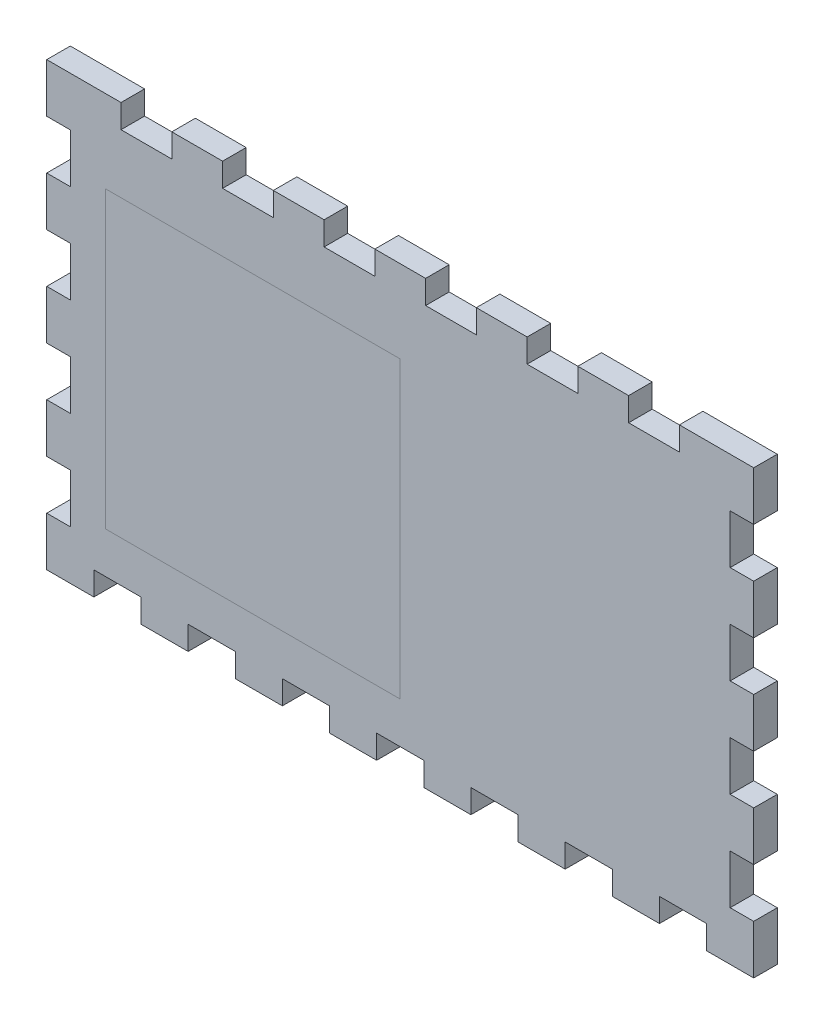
SolidWorks part; units mm, degrees
ref_plane "Front Plane" through (0, 0, 0) normal (0, 0, 1) x (1, 0, 0)
ref_plane "Top Plane" through (0, 0, 0) normal (0, 1, 0) x (1, 0, 0)
ref_plane "Right Plane" through (0, 0, 0) normal (1, 0, 0) x (0, 0, -1)
sketch "Model" plane through (0, 0, 0) normal (0, 0, 1) x (1, 0, 0)
  line L0 (83, 83) -> (87, 83)
  line L1 (87, 83) -> (87, 79)
  line L2 (87, 79) -> (95, 79)
  line L3 (95, 79) -> (95, 83)
  line L4 (95, 83) -> (103, 83)
  line L5 (103, 83) -> (103, 79)
  line L6 (103, 79) -> (111, 79)
  line L7 (111, 79) -> (111, 83)
  line L8 (111, 83) -> (119, 83)
  line L9 (119, 83) -> (119, 79)
  line L10 (119, 79) -> (127, 79)
  line L11 (127, 79) -> (127, 83)
  line L12 (127, 83) -> (135, 83)
  line L13 (135, 83) -> (135, 79)
  line L14 (135, 79) -> (143, 79)
  line L15 (143, 79) -> (143, 83)
  line L16 (143, 83) -> (151, 83)
  line L17 (151, 83) -> (151, 79)
  line L18 (151, 79) -> (159, 79)
  line L19 (159, 79) -> (159, 83)
  line L20 (159, 83) -> (167, 83)
  line L21 (167, 83) -> (167, 79)
  line L22 (167, 79) -> (175, 79)
  line L23 (175, 79) -> (175, 83)
  line L24 (175, 83) -> (183, 83)
  line L25 (183, 83) -> (183, 79)
  line L26 (183, 79) -> (191, 79)
  line L27 (191, 79) -> (191, 83)
  line L28 (191, 83) -> (195, 83)
  line L29 (195, 83) -> (195, 91.61)
  line L30 (195, 91.61) -> (199, 91.61)
  line L31 (199, 91.61) -> (199, 100.23)
  line L32 (199, 100.23) -> (195, 100.23)
  line L33 (195, 100.23) -> (195, 108.85)
  line L34 (195, 108.85) -> (199, 108.85)
  line L35 (199, 108.85) -> (199, 117.46)
  line L36 (199, 117.46) -> (195, 117.46)
  line L37 (195, 117.46) -> (195, 126.08)
  line L38 (195, 126.08) -> (199, 126.08)
  line L39 (199, 126.08) -> (199, 134.69)
  line L40 (199, 134.69) -> (195, 134.69)
  line L41 (195, 134.69) -> (195, 143.31)
  line L42 (195, 143.31) -> (199, 143.31)
  line L43 (199, 143.31) -> (199, 151.92)
  line L44 (199, 151.92) -> (195, 151.92)
  line L45 (195, 151.92) -> (195, 160.54)
  line L46 (195, 160.54) -> (199, 160.54)
  line L47 (199, 160.54) -> (199, 169.15)
  line L48 (199, 169.15) -> (195, 169.15)
  line L49 (195, 169.15) -> (195, 177.77)
  line L50 (195, 177.77) -> (199, 177.77)
  line L51 (199, 177.77) -> (199, 186.38)
  line L52 (199, 186.38) -> (195, 186.38)
  line L53 (195, 186.38) -> (195, 195)
  line L54 (195, 195) -> (191, 195)
  line L55 (191, 195) -> (191, 199)
  line L56 (191, 199) -> (183, 199)
  line L57 (183, 199) -> (183, 195)
  line L58 (183, 195) -> (175, 195)
  line L59 (175, 195) -> (175, 199)
  line L60 (175, 199) -> (167, 199)
  line L61 (167, 199) -> (167, 195)
  line L62 (167, 195) -> (159, 195)
  line L63 (159, 195) -> (159, 199)
  line L64 (159, 199) -> (151, 199)
  line L65 (151, 199) -> (151, 195)
  line L66 (151, 195) -> (143, 195)
  line L67 (143, 195) -> (143, 199)
  line L68 (143, 199) -> (135, 199)
  line L69 (135, 199) -> (135, 195)
  line L70 (135, 195) -> (127, 195)
  line L71 (127, 195) -> (127, 199)
  line L72 (127, 199) -> (119, 199)
  line L73 (119, 199) -> (119, 195)
  line L74 (119, 195) -> (111, 195)
  line L75 (111, 195) -> (111, 199)
  line L76 (111, 199) -> (103, 199)
  line L77 (103, 199) -> (103, 195)
  line L78 (103, 195) -> (95, 195)
  line L79 (95, 195) -> (95, 199)
  line L80 (95, 199) -> (87, 199)
  line L81 (87, 199) -> (87, 195)
  line L82 (87, 195) -> (83, 195)
  line L83 (83, 195) -> (83, 186.38)
  line L84 (83, 186.38) -> (79, 186.38)
  line L85 (79, 186.38) -> (79, 177.77)
  line L86 (79, 177.77) -> (83, 177.77)
  line L87 (83, 177.77) -> (83, 169.15)
  line L88 (83, 169.15) -> (79, 169.15)
  line L89 (79, 169.15) -> (79, 160.54)
  line L90 (79, 160.54) -> (83, 160.54)
  line L91 (83, 160.54) -> (83, 151.92)
  line L92 (83, 151.92) -> (79, 151.92)
  line L93 (79, 151.92) -> (79, 143.31)
  line L94 (79, 143.31) -> (83, 143.31)
  line L95 (83, 143.31) -> (83, 134.69)
  line L96 (83, 134.69) -> (79, 134.69)
  line L97 (79, 134.69) -> (79, 126.08)
  line L98 (79, 126.08) -> (83, 126.08)
  line L99 (83, 126.08) -> (83, 117.46)
  line L100 (83, 117.46) -> (79, 117.46)
  line L101 (79, 117.46) -> (79, 108.85)
  line L102 (79, 108.85) -> (83, 108.85)
  line L103 (83, 108.85) -> (83, 100.23)
  line L104 (83, 100.23) -> (79, 100.23)
  line L105 (79, 100.23) -> (79, 91.61)
  line L106 (79, 91.61) -> (83, 91.61)
  line L107 (83, 91.61) -> (83, 83)
  line L108 (83, 0) -> (91.61, 0)
  line L109 (91.61, 0) -> (91.61, 4)
  line L110 (91.61, 4) -> (100.23, 4)
  line L111 (100.23, 4) -> (100.23, 0)
  line L112 (100.23, 0) -> (108.85, 0)
  line L113 (108.85, 0) -> (108.85, 4)
  line L114 (108.85, 4) -> (117.46, 4)
  line L115 (117.46, 4) -> (117.46, 0)
  line L116 (117.46, 0) -> (126.08, 0)
  line L117 (126.08, 0) -> (126.08, 4)
  line L118 (126.08, 4) -> (134.69, 4)
  line L119 (134.69, 4) -> (134.69, 0)
  line L120 (134.69, 0) -> (143.31, 0)
  line L121 (143.31, 0) -> (143.31, 4)
  line L122 (143.31, 4) -> (151.92, 4)
  line L123 (151.92, 4) -> (151.92, 0)
  line L124 (151.92, 0) -> (160.54, 0)
  line L125 (160.54, 0) -> (160.54, 4)
  line L126 (160.54, 4) -> (169.15, 4)
  line L127 (169.15, 4) -> (169.15, 0)
  line L128 (169.15, 0) -> (177.77, 0)
  line L129 (177.77, 0) -> (177.77, 4)
  line L130 (177.77, 4) -> (186.38, 4)
  line L131 (186.38, 4) -> (186.38, 0)
  line L132 (186.38, 0) -> (195, 0)
  line L133 (195, 0) -> (199, 0)
  line L134 (199, 0) -> (199, 8.33)
  line L135 (199, 8.33) -> (195, 8.33)
  line L136 (195, 8.33) -> (195, 16.67)
  line L137 (195, 16.67) -> (199, 16.67)
  line L138 (199, 16.67) -> (199, 25)
  line L139 (199, 25) -> (195, 25)
  line L140 (195, 25) -> (195, 33.33)
  line L141 (195, 33.33) -> (199, 33.33)
  line L142 (199, 33.33) -> (199, 41.67)
  line L143 (199, 41.67) -> (195, 41.67)
  line L144 (195, 41.67) -> (195, 50)
  line L145 (195, 50) -> (199, 50)
  line L146 (199, 50) -> (199, 58.33)
  line L147 (199, 58.33) -> (195, 58.33)
  line L148 (195, 58.33) -> (195, 66.67)
  line L149 (195, 66.67) -> (199, 66.67)
  line L150 (199, 66.67) -> (199, 75)
  line L151 (199, 75) -> (191, 75)
  line L152 (191, 75) -> (191, 71)
  line L153 (191, 71) -> (183, 71)
  line L154 (183, 71) -> (183, 75)
  line L155 (183, 75) -> (175, 75)
  line L156 (175, 75) -> (175, 71)
  line L157 (175, 71) -> (167, 71)
  line L158 (167, 71) -> (167, 75)
  line L159 (167, 75) -> (159, 75)
  line L160 (159, 75) -> (159, 71)
  line L161 (159, 71) -> (151, 71)
  line L162 (151, 71) -> (151, 75)
  line L163 (151, 75) -> (143, 75)
  line L164 (143, 75) -> (143, 71)
  line L165 (143, 71) -> (135, 71)
  line L166 (135, 71) -> (135, 75)
  line L167 (135, 75) -> (127, 75)
  line L168 (127, 75) -> (127, 71)
  line L169 (127, 71) -> (119, 71)
  line L170 (119, 71) -> (119, 75)
  line L171 (119, 75) -> (111, 75)
  line L172 (111, 75) -> (111, 71)
  line L173 (111, 71) -> (103, 71)
  line L174 (103, 71) -> (103, 75)
  line L175 (103, 75) -> (95, 75)
  line L176 (95, 75) -> (95, 71)
  line L177 (95, 71) -> (87, 71)
  line L178 (87, 71) -> (87, 75)
  line L179 (87, 75) -> (79, 75)
  line L180 (79, 75) -> (79, 66.67)
  line L181 (79, 66.67) -> (83, 66.67)
  line L182 (83, 66.67) -> (83, 58.33)
  line L183 (83, 58.33) -> (79, 58.33)
  line L184 (79, 58.33) -> (79, 50)
  line L185 (79, 50) -> (83, 50)
  line L186 (83, 50) -> (83, 41.67)
  line L187 (83, 41.67) -> (79, 41.67)
  line L188 (79, 41.67) -> (79, 33.33)
  line L189 (79, 33.33) -> (83, 33.33)
  line L190 (83, 33.33) -> (83, 25)
  line L191 (83, 25) -> (79, 25)
  line L192 (79, 25) -> (79, 16.67)
  line L193 (79, 16.67) -> (83, 16.67)
  line L194 (83, 16.67) -> (83, 8.33)
  line L195 (83, 8.33) -> (79, 8.33)
  line L196 (79, 8.33) -> (79, 0)
  line L197 (79, 0) -> (83, 0)
  line L198 (83, 278) -> (91.61, 278)
  line L199 (91.61, 278) -> (91.61, 274)
  line L200 (91.61, 274) -> (100.23, 274)
  line L201 (100.23, 274) -> (100.23, 278)
  line L202 (100.23, 278) -> (108.85, 278)
  line L203 (108.85, 278) -> (108.85, 274)
  line L204 (108.85, 274) -> (117.46, 274)
  line L205 (117.46, 274) -> (117.46, 278)
  line L206 (117.46, 278) -> (126.08, 278)
  line L207 (126.08, 278) -> (126.08, 274)
  line L208 (126.08, 274) -> (134.69, 274)
  line L209 (134.69, 274) -> (134.69, 278)
  line L210 (134.69, 278) -> (143.31, 278)
  line L211 (143.31, 278) -> (143.31, 274)
  line L212 (143.31, 274) -> (151.92, 274)
  line L213 (151.92, 274) -> (151.92, 278)
  line L214 (151.92, 278) -> (160.54, 278)
  line L215 (160.54, 278) -> (160.54, 274)
  line L216 (160.54, 274) -> (169.15, 274)
  line L217 (169.15, 274) -> (169.15, 278)
  line L218 (169.15, 278) -> (177.77, 278)
  line L219 (177.77, 278) -> (177.77, 274)
  line L220 (177.77, 274) -> (186.38, 274)
  line L221 (186.38, 274) -> (186.38, 278)
  line L222 (186.38, 278) -> (195, 278)
  line L223 (195, 278) -> (199, 278)
  line L224 (199, 278) -> (199, 269.67)
  line L225 (199, 269.67) -> (195, 269.67)
  line L226 (195, 269.67) -> (195, 261.33)
  line L227 (195, 261.33) -> (199, 261.33)
  line L228 (199, 261.33) -> (199, 253)
  line L229 (199, 253) -> (195, 253)
  line L230 (195, 253) -> (195, 244.67)
  line L231 (195, 244.67) -> (199, 244.67)
  line L232 (199, 244.67) -> (199, 236.33)
  line L233 (199, 236.33) -> (195, 236.33)
  line L234 (195, 236.33) -> (195, 228)
  line L235 (195, 228) -> (199, 228)
  line L236 (199, 228) -> (199, 219.67)
  line L237 (199, 219.67) -> (195, 219.67)
  line L238 (195, 219.67) -> (195, 211.33)
  line L239 (195, 211.33) -> (199, 211.33)
  line L240 (199, 211.33) -> (199, 203)
  line L241 (199, 203) -> (191, 203)
  line L242 (191, 203) -> (191, 207)
  line L243 (191, 207) -> (183, 207)
  line L244 (183, 207) -> (183, 203)
  line L245 (183, 203) -> (175, 203)
  line L246 (175, 203) -> (175, 207)
  line L247 (175, 207) -> (167, 207)
  line L248 (167, 207) -> (167, 203)
  line L249 (167, 203) -> (159, 203)
  line L250 (159, 203) -> (159, 207)
  line L251 (159, 207) -> (151, 207)
  line L252 (151, 207) -> (151, 203)
  line L253 (151, 203) -> (143, 203)
  line L254 (143, 203) -> (143, 207)
  line L255 (143, 207) -> (135, 207)
  line L256 (135, 207) -> (135, 203)
  line L257 (135, 203) -> (127, 203)
  line L258 (127, 203) -> (127, 207)
  line L259 (127, 207) -> (119, 207)
  line L260 (119, 207) -> (119, 203)
  line L261 (119, 203) -> (111, 203)
  line L262 (111, 203) -> (111, 207)
  line L263 (111, 207) -> (103, 207)
  line L264 (103, 207) -> (103, 203)
  line L265 (103, 203) -> (95, 203)
  line L266 (95, 203) -> (95, 207)
  line L267 (95, 207) -> (87, 207)
  line L268 (87, 207) -> (87, 203)
  line L269 (87, 203) -> (79, 203)
  line L270 (79, 203) -> (79, 211.33)
  line L271 (79, 211.33) -> (83, 211.33)
  line L272 (83, 211.33) -> (83, 219.67)
  line L273 (83, 219.67) -> (79, 219.67)
  line L274 (79, 219.67) -> (79, 228)
  line L275 (79, 228) -> (83, 228)
  line L276 (83, 228) -> (83, 236.33)
  line L277 (83, 236.33) -> (79, 236.33)
  line L278 (79, 236.33) -> (79, 244.67)
  line L279 (79, 244.67) -> (83, 244.67)
  line L280 (83, 244.67) -> (83, 253)
  line L281 (83, 253) -> (79, 253)
  line L282 (79, 253) -> (79, 261.33)
  line L283 (79, 261.33) -> (83, 261.33)
  line L284 (83, 261.33) -> (83, 269.67)
  line L285 (83, 269.67) -> (79, 269.67)
  line L286 (79, 269.67) -> (79, 278)
  line L287 (79, 278) -> (83, 278)
  line L288 (0, 83) -> (0, 91.61)
  line L289 (0, 91.61) -> (4, 91.61)
  line L290 (4, 91.61) -> (4, 100.23)
  line L291 (4, 100.23) -> (0, 100.23)
  line L292 (0, 100.23) -> (0, 108.85)
  line L293 (0, 108.85) -> (4, 108.85)
  line L294 (4, 108.85) -> (4, 117.46)
  line L295 (4, 117.46) -> (0, 117.46)
  line L296 (0, 117.46) -> (0, 126.08)
  line L297 (0, 126.08) -> (4, 126.08)
  line L298 (4, 126.08) -> (4, 134.69)
  line L299 (4, 134.69) -> (0, 134.69)
  line L300 (0, 134.69) -> (0, 143.31)
  line L301 (0, 143.31) -> (4, 143.31)
  line L302 (4, 143.31) -> (4, 151.92)
  line L303 (4, 151.92) -> (0, 151.92)
  line L304 (0, 151.92) -> (0, 160.54)
  line L305 (0, 160.54) -> (4, 160.54)
  line L306 (4, 160.54) -> (4, 169.15)
  line L307 (4, 169.15) -> (0, 169.15)
  line L308 (0, 169.15) -> (0, 177.77)
  line L309 (0, 177.77) -> (4, 177.77)
  line L310 (4, 177.77) -> (4, 186.38)
  line L311 (4, 186.38) -> (0, 186.38)
  line L312 (0, 186.38) -> (0, 195)
  line L313 (0, 195) -> (8.33, 195)
  line L314 (8.33, 195) -> (8.33, 199)
  line L315 (8.33, 199) -> (16.67, 199)
  line L316 (16.67, 199) -> (16.67, 195)
  line L317 (16.67, 195) -> (25, 195)
  line L318 (25, 195) -> (25, 199)
  line L319 (25, 199) -> (33.33, 199)
  line L320 (33.33, 199) -> (33.33, 195)
  line L321 (33.33, 195) -> (41.67, 195)
  line L322 (41.67, 195) -> (41.67, 199)
  line L323 (41.67, 199) -> (50, 199)
  line L324 (50, 199) -> (50, 195)
  line L325 (50, 195) -> (58.33, 195)
  line L326 (58.33, 195) -> (58.33, 199)
  line L327 (58.33, 199) -> (66.67, 199)
  line L328 (66.67, 199) -> (66.67, 195)
  line L329 (66.67, 195) -> (75, 195)
  line L330 (75, 195) -> (75, 186.38)
  line L331 (75, 186.38) -> (71, 186.38)
  line L332 (71, 186.38) -> (71, 177.77)
  line L333 (71, 177.77) -> (75, 177.77)
  line L334 (75, 177.77) -> (75, 169.15)
  line L335 (75, 169.15) -> (71, 169.15)
  line L336 (71, 169.15) -> (71, 160.54)
  line L337 (71, 160.54) -> (75, 160.54)
  line L338 (75, 160.54) -> (75, 151.92)
  line L339 (75, 151.92) -> (71, 151.92)
  line L340 (71, 151.92) -> (71, 143.31)
  line L341 (71, 143.31) -> (75, 143.31)
  line L342 (75, 143.31) -> (75, 134.69)
  line L343 (75, 134.69) -> (71, 134.69)
  line L344 (71, 134.69) -> (71, 126.08)
  line L345 (71, 126.08) -> (75, 126.08)
  line L346 (75, 126.08) -> (75, 117.46)
  line L347 (75, 117.46) -> (71, 117.46)
  line L348 (71, 117.46) -> (71, 108.85)
  line L349 (71, 108.85) -> (75, 108.85)
  line L350 (75, 108.85) -> (75, 100.23)
  line L351 (75, 100.23) -> (71, 100.23)
  line L352 (71, 100.23) -> (71, 91.61)
  line L353 (71, 91.61) -> (75, 91.61)
  line L354 (75, 91.61) -> (75, 83)
  line L355 (75, 83) -> (66.67, 83)
  line L356 (66.67, 83) -> (66.67, 79)
  line L357 (66.67, 79) -> (58.33, 79)
  line L358 (58.33, 79) -> (58.33, 83)
  line L359 (58.33, 83) -> (50, 83)
  line L360 (50, 83) -> (50, 79)
  line L361 (50, 79) -> (41.67, 79)
  line L362 (41.67, 79) -> (41.67, 83)
  line L363 (41.67, 83) -> (33.33, 83)
  line L364 (33.33, 83) -> (33.33, 79)
  line L365 (33.33, 79) -> (25, 79)
  line L366 (25, 79) -> (25, 83)
  line L367 (25, 83) -> (16.67, 83)
  line L368 (16.67, 83) -> (16.67, 79)
  line L369 (16.67, 79) -> (8.33, 79)
  line L370 (8.33, 79) -> (8.33, 83)
  line L371 (8.33, 83) -> (0, 83)
  line L372 (278, 83) -> (278, 91.61)
  line L373 (278, 91.61) -> (274, 91.61)
  line L374 (274, 91.61) -> (274, 100.23)
  line L375 (274, 100.23) -> (278, 100.23)
  line L376 (278, 100.23) -> (278, 108.85)
  line L377 (278, 108.85) -> (274, 108.85)
  line L378 (274, 108.85) -> (274, 117.46)
  line L379 (274, 117.46) -> (278, 117.46)
  line L380 (278, 117.46) -> (278, 126.08)
  line L381 (278, 126.08) -> (274, 126.08)
  line L382 (274, 126.08) -> (274, 134.69)
  line L383 (274, 134.69) -> (278, 134.69)
  line L384 (278, 134.69) -> (278, 143.31)
  line L385 (278, 143.31) -> (274, 143.31)
  line L386 (274, 143.31) -> (274, 151.92)
  line L387 (274, 151.92) -> (278, 151.92)
  line L388 (278, 151.92) -> (278, 160.54)
  line L389 (278, 160.54) -> (274, 160.54)
  line L390 (274, 160.54) -> (274, 169.15)
  line L391 (274, 169.15) -> (278, 169.15)
  line L392 (278, 169.15) -> (278, 177.77)
  line L393 (278, 177.77) -> (274, 177.77)
  line L394 (274, 177.77) -> (274, 186.38)
  line L395 (274, 186.38) -> (278, 186.38)
  line L396 (278, 186.38) -> (278, 195)
  line L397 (278, 195) -> (269.67, 195)
  line L398 (269.67, 195) -> (269.67, 199)
  line L399 (269.67, 199) -> (261.33, 199)
  line L400 (261.33, 199) -> (261.33, 195)
  line L401 (261.33, 195) -> (253, 195)
  line L402 (253, 195) -> (253, 199)
  line L403 (253, 199) -> (244.67, 199)
  line L404 (244.67, 199) -> (244.67, 195)
  line L405 (244.67, 195) -> (236.33, 195)
  line L406 (236.33, 195) -> (236.33, 199)
  line L407 (236.33, 199) -> (228, 199)
  line L408 (228, 199) -> (228, 195)
  line L409 (228, 195) -> (219.67, 195)
  line L410 (219.67, 195) -> (219.67, 199)
  line L411 (219.67, 199) -> (211.33, 199)
  line L412 (211.33, 199) -> (211.33, 195)
  line L413 (211.33, 195) -> (203, 195)
  line L414 (203, 195) -> (203, 186.38)
  line L415 (203, 186.38) -> (207, 186.38)
  line L416 (207, 186.38) -> (207, 177.77)
  line L417 (207, 177.77) -> (203, 177.77)
  line L418 (203, 177.77) -> (203, 169.15)
  line L419 (203, 169.15) -> (207, 169.15)
  line L420 (207, 169.15) -> (207, 160.54)
  line L421 (207, 160.54) -> (203, 160.54)
  line L422 (203, 160.54) -> (203, 151.92)
  line L423 (203, 151.92) -> (207, 151.92)
  line L424 (207, 151.92) -> (207, 143.31)
  line L425 (207, 143.31) -> (203, 143.31)
  line L426 (203, 143.31) -> (203, 134.69)
  line L427 (203, 134.69) -> (207, 134.69)
  line L428 (207, 134.69) -> (207, 126.08)
  line L429 (207, 126.08) -> (203, 126.08)
  line L430 (203, 126.08) -> (203, 117.46)
  line L431 (203, 117.46) -> (207, 117.46)
  line L432 (207, 117.46) -> (207, 108.85)
  line L433 (207, 108.85) -> (203, 108.85)
  line L434 (203, 108.85) -> (203, 100.23)
  line L435 (203, 100.23) -> (207, 100.23)
  line L436 (207, 100.23) -> (207, 91.61)
  line L437 (207, 91.61) -> (203, 91.61)
  line L438 (203, 91.61) -> (203, 83)
  line L439 (203, 83) -> (211.33, 83)
  line L440 (211.33, 83) -> (211.33, 79)
  line L441 (211.33, 79) -> (219.67, 79)
  line L442 (219.67, 79) -> (219.67, 83)
  line L443 (219.67, 83) -> (228, 83)
  line L444 (228, 83) -> (228, 79)
  line L445 (228, 79) -> (236.33, 79)
  line L446 (236.33, 79) -> (236.33, 83)
  line L447 (236.33, 83) -> (244.67, 83)
  line L448 (244.67, 83) -> (244.67, 79)
  line L449 (244.67, 79) -> (253, 79)
  line L450 (253, 79) -> (253, 83)
  line L451 (253, 83) -> (261.33, 83)
  line L452 (261.33, 83) -> (261.33, 79)
  line L453 (261.33, 79) -> (269.67, 79)
  line L454 (269.67, 79) -> (269.67, 83)
  line L455 (269.67, 83) -> (278, 83)
  line L456 (83, 286) -> (91.61, 286)
  line L457 (91.61, 286) -> (91.61, 282)
  line L458 (91.61, 282) -> (100.23, 282)
  line L459 (100.23, 282) -> (100.23, 286)
  line L460 (100.23, 286) -> (108.85, 286)
  line L461 (108.85, 286) -> (108.85, 282)
  line L462 (108.85, 282) -> (117.46, 282)
  line L463 (117.46, 282) -> (117.46, 286)
  line L464 (117.46, 286) -> (126.08, 286)
  line L465 (126.08, 286) -> (126.08, 282)
  line L466 (126.08, 282) -> (134.69, 282)
  line L467 (134.69, 282) -> (134.69, 286)
  line L468 (134.69, 286) -> (143.31, 286)
  line L469 (143.31, 286) -> (143.31, 282)
  line L470 (143.31, 282) -> (151.92, 282)
  line L471 (151.92, 282) -> (151.92, 286)
  line L472 (151.92, 286) -> (160.54, 286)
  line L473 (160.54, 286) -> (160.54, 282)
  line L474 (160.54, 282) -> (169.15, 282)
  line L475 (169.15, 282) -> (169.15, 286)
  line L476 (169.15, 286) -> (177.77, 286)
  line L477 (177.77, 286) -> (177.77, 282)
  line L478 (177.77, 282) -> (186.38, 282)
  line L479 (186.38, 282) -> (186.38, 286)
  line L480 (186.38, 286) -> (195, 286)
  line L481 (195, 286) -> (195, 294.62)
  line L482 (195, 294.62) -> (199, 294.62)
  line L483 (199, 294.62) -> (199, 303.23)
  line L484 (199, 303.23) -> (195, 303.23)
  line L485 (195, 303.23) -> (195, 311.85)
  line L486 (195, 311.85) -> (199, 311.85)
  line L487 (199, 311.85) -> (199, 320.46)
  line L488 (199, 320.46) -> (195, 320.46)
  line L489 (195, 320.46) -> (195, 329.08)
  line L490 (195, 329.08) -> (199, 329.08)
  line L491 (199, 329.08) -> (199, 337.69)
  line L492 (199, 337.69) -> (195, 337.69)
  line L493 (195, 337.69) -> (195, 346.31)
  line L494 (195, 346.31) -> (199, 346.31)
  line L495 (199, 346.31) -> (199, 354.92)
  line L496 (199, 354.92) -> (195, 354.92)
  line L497 (195, 354.92) -> (195, 363.54)
  line L498 (195, 363.54) -> (199, 363.54)
  line L499 (199, 363.54) -> (199, 372.15)
  line L500 (199, 372.15) -> (195, 372.15)
  line L501 (195, 372.15) -> (195, 380.77)
  line L502 (195, 380.77) -> (199, 380.77)
  line L503 (199, 380.77) -> (199, 389.38)
  line L504 (199, 389.38) -> (195, 389.38)
  line L505 (195, 389.38) -> (195, 398)
  line L506 (195, 398) -> (186.38, 398)
  line L507 (186.38, 398) -> (186.38, 402)
  line L508 (186.38, 402) -> (177.77, 402)
  line L509 (177.77, 402) -> (177.77, 398)
  line L510 (177.77, 398) -> (169.15, 398)
  line L511 (169.15, 398) -> (169.15, 402)
  line L512 (169.15, 402) -> (160.54, 402)
  line L513 (160.54, 402) -> (160.54, 398)
  line L514 (160.54, 398) -> (151.92, 398)
  line L515 (151.92, 398) -> (151.92, 402)
  line L516 (151.92, 402) -> (143.31, 402)
  line L517 (143.31, 402) -> (143.31, 398)
  line L518 (143.31, 398) -> (134.69, 398)
  line L519 (134.69, 398) -> (134.69, 402)
  line L520 (134.69, 402) -> (126.08, 402)
  line L521 (126.08, 402) -> (126.08, 398)
  line L522 (126.08, 398) -> (117.46, 398)
  line L523 (117.46, 398) -> (117.46, 402)
  line L524 (117.46, 402) -> (108.85, 402)
  line L525 (108.85, 402) -> (108.85, 398)
  line L526 (108.85, 398) -> (100.23, 398)
  line L527 (100.23, 398) -> (100.23, 402)
  line L528 (100.23, 402) -> (91.61, 402)
  line L529 (91.61, 402) -> (91.61, 398)
  line L530 (91.61, 398) -> (83, 398)
  line L531 (83, 398) -> (83, 389.38)
  line L532 (83, 389.38) -> (79, 389.38)
  line L533 (79, 389.38) -> (79, 380.77)
  line L534 (79, 380.77) -> (83, 380.77)
  line L535 (83, 380.77) -> (83, 372.15)
  line L536 (83, 372.15) -> (79, 372.15)
  line L537 (79, 372.15) -> (79, 363.54)
  line L538 (79, 363.54) -> (83, 363.54)
  line L539 (83, 363.54) -> (83, 354.92)
  line L540 (83, 354.92) -> (79, 354.92)
  line L541 (79, 354.92) -> (79, 346.31)
  line L542 (79, 346.31) -> (83, 346.31)
  line L543 (83, 346.31) -> (83, 337.69)
  line L544 (83, 337.69) -> (79, 337.69)
  line L545 (79, 337.69) -> (79, 329.08)
  line L546 (79, 329.08) -> (83, 329.08)
  line L547 (83, 329.08) -> (83, 320.46)
  line L548 (83, 320.46) -> (79, 320.46)
  line L549 (79, 320.46) -> (79, 311.85)
  line L550 (79, 311.85) -> (83, 311.85)
  line L551 (83, 311.85) -> (83, 303.23)
  line L552 (83, 303.23) -> (79, 303.23)
  line L553 (79, 303.23) -> (79, 294.62)
  line L554 (79, 294.62) -> (83, 294.62)
  line L555 (83, 294.62) -> (83, 286)
extrude "Boss-Extrude1" add sketch "Model" along normal blind 4 contours L287 L286 L285 L284 L283 L282 L281 L280 L279 L278 L277 L276 L275 L274 L273 L272 L271 L270 L269 L268 L267 L266 L265 L264 L263 L262 L261 L260 L259 L258 L257 L256 L255 L254 L253 L252 L251 L250 L249 L248 L247 L246 L245 L244 L243 L242 L241 L240 L239 L238 L237
sketch "Sketch1" plane through (0, 0, 0) normal (0, 0, 1) x (1, 0, 0)
  line L0 (91.61, 274) -> (100.23, 274) construction
  line L1 (89, 264) -> (139, 264)
  line L2 (89, 264) -> (89, 214)
  line L3 (89, 214) -> (139, 214)
  line L4 (139, 264) -> (139, 214)
  line L5 (79, 253) -> (79, 261.33) construction
  point P4 (92.5236, 263.5908)
  dimension "D1" = 50
  dimension "D2" = 50
  dimension "D3" = 10
  dimension "D4" = 10
